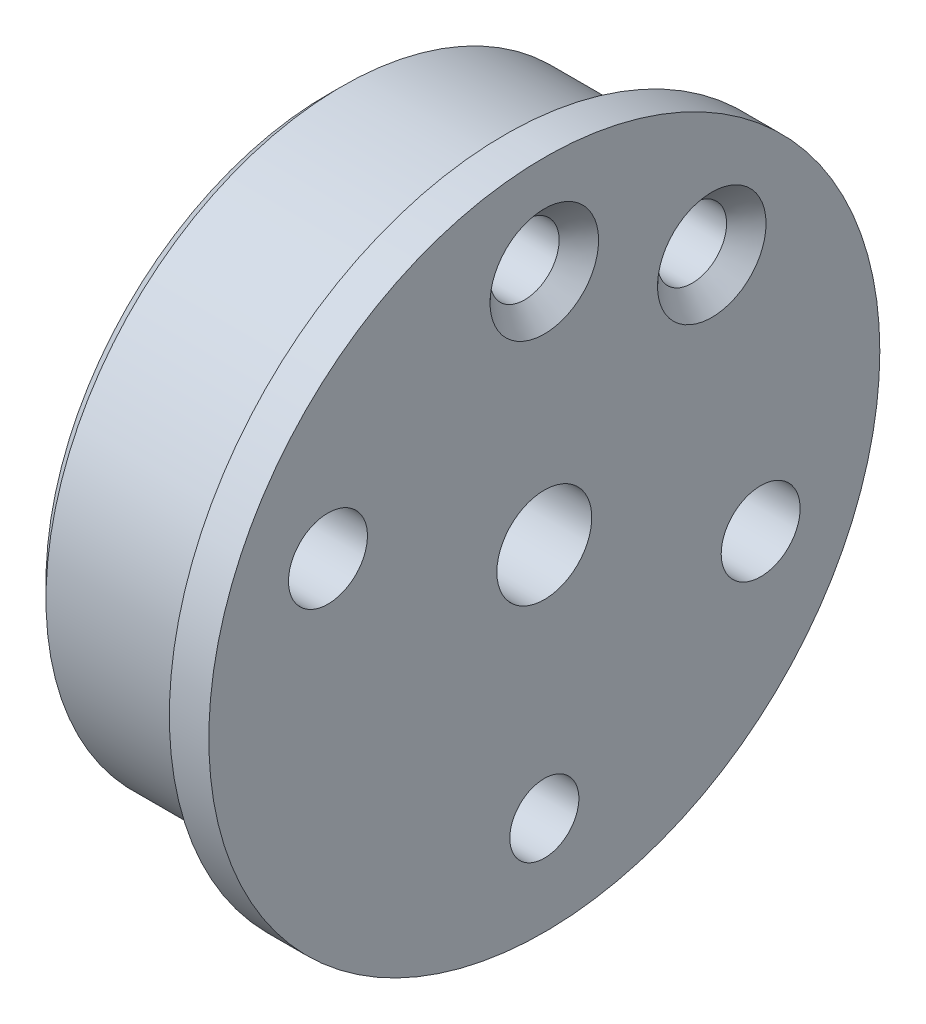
SolidWorks part; units mm, degrees
ref_plane "Plan de face" through (0, 0, 0) normal (0, 0, 1) x (1, 0, 0)
ref_plane "Plan de dessus" through (0, 0, 0) normal (0, 1, 0) x (1, 0, 0)
ref_plane "Plan de droite" through (0, 0, 0) normal (1, 0, 0) x (0, 0, -1)
sketch "Esquisse1" plane through (0, 0, 0) normal (0, 0, 1) x (1, 0, 0)
  line L0 (21.586, 0) -> (-37.5777, 0) construction
  line L1 (0, 0) -> (0, 34)
  line L2 (0, 34) -> (-4, 34)
  line L3 (-4, 34) -> (-4, 30)
  line L4 (-4, 30) -> (-20.5, 30)
  line L5 (-22, 28.5) -> (-22, 0)
  line L6 (-22, 0) -> (0, 0)
  line L7 (-20.5, 30) -> (-22, 28.5)
  point P8 (-22, 30)
  dimension "D1" = 18
  dimension "D2" = 4
  dimension "D3" = 30
  dimension "D4" = 4
  dimension "D7" = 1.5
revolve "Révolution1" add sketch "Esquisse1" angle 360 about L0
sketch "Esquisse2" plane through (-22, 0, 0) normal (-1, 0, 0) x (0, 0, 1)
  circle A0 centre (0, 0) radius 4.8079
  circle A1 centre (21.9251, 9.7617) radius 4
  circle A2 centre (-21.9251, -9.7617) radius 4
  circle A3 centre (0, 24) radius 3.5
  circle A4 centre (-16.9706, 16.9706) radius 3.5
  circle A5 centre (0, -24) radius 3.5
  dimension "D1" = 7
extrude "Enlèv. mat.-Extru.1" cut sketch "Esquisse2" against normal through all
chamfer "Chanfrein1" distance 2 angle 45 2 edges at (0, 16.9706, -13.4706) (0, 24, 3.5)
